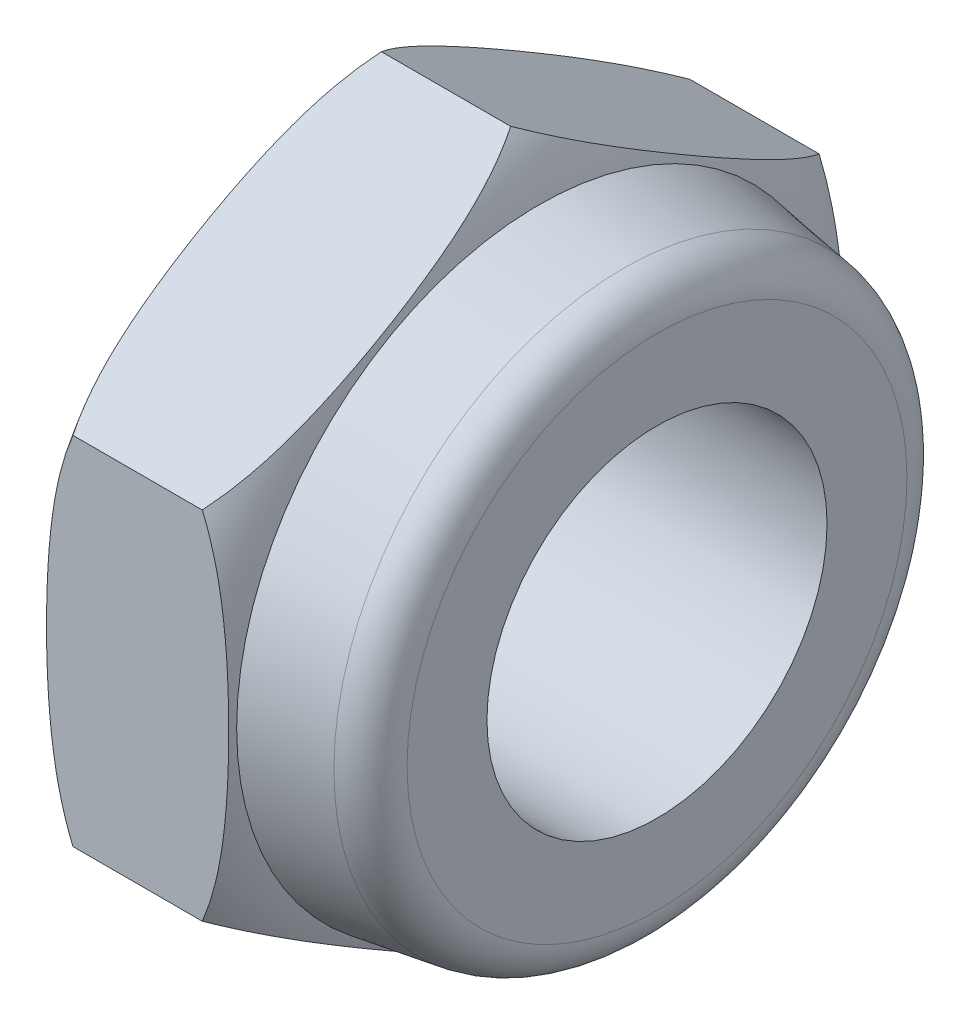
SolidWorks part; units mm, degrees
ref_plane "Front" through (0, 0, 0) normal (0, 0, 1) x (1, 0, 0)
ref_plane "Top" through (0, 0, 0) normal (0, 1, 0) x (1, 0, 0)
ref_plane "Right" through (0, 0, 0) normal (1, 0, 0) x (0, 0, -1)
sketch "Sketch1" plane through (0, 0, 0) normal (1, 0, 0) x (0, 0, -1)
  circle A0 centre (0, 0) radius 2.54
  dimension "D1" = 5.08
extrude "Place Holder" add sketch "Sketch1" along normal blind 0.254
sketch "Sketch4" plane through (0, 0, 0) normal (0, 0, 1) x (1, 0, 0)
  line L0 (0, 3.5014) -> (6.35, 3.5014)
  line L1 (3.3381, 7.3323) -> (0.6751, 7.3323)
  line L2 (0, 5.4993) -> (4.0132, 5.4993) construction
  line L3 (0, 5.4993) -> (0, 3.5014)
  line L4 (6.35, 5.1462) -> (6.35, 3.5014)
  line L5 (0, 3.5014) -> (0, 0) construction
  line L6 (3.9187, 6.2239) -> (5.6542, 5.9572)
  line L7 (0, 0) -> (14.2149, 0) construction
  arc A0 (0.6751, 7.3323) -> (0, 5.4993) centre (2.8263, 5.4993) ccw
  arc A1 (3.9187, 6.2239) -> (3.3381, 7.3323) centre (1.1869, 5.4993) ccw
  arc A2 (6.35, 5.1462) -> (5.6542, 5.9572) centre (5.5296, 5.1462) ccw
revolve "Revolve2" add sketch "Sketch4" angle 360 about L7
sketch "Sketch5" plane through (0, 0, 0) normal (-1, 0, 0) x (0, 0, 1)
  line L1 (0, 7.3323) -> (-6.35, 3.6662)
  line L2 (-6.35, 3.6662) -> (-6.35, -3.6662)
  line L3 (-6.35, -3.6662) -> (0, -7.3323)
  line L4 (0, -7.3323) -> (6.35, -3.6662)
  line L5 (6.35, -3.6662) -> (6.35, 3.6662)
  line L6 (6.35, 3.6662) -> (0, 7.3323)
  circle A0 centre (0, 0) radius 6.35 construction
  circle A1 centre (0, 0) radius 8.9002
extrude "Cut-Extrude2" cut sketch "Sketch5" against normal through all
sketch "Sketch6" plane through (0, 0, 0) normal (0, 0, 1) x (1, 0, 0)
  line L0 (0, 7.8105) -> (2.0433, 9.525)
  line L1 (2.0433, 9.525) -> (5.5626, 9.525)
  line L2 (5.5626, 9.525) -> (5.5626, 4.5987)
  line L3 (0, 7.8105) -> (0, 5.3518)
  line L4 (0.7938, 4.558) -> (5.522, 4.558)
  line L5 (5.522, 4.558) -> (5.5626, 4.5987)
  line L6 (0, 0) -> (29.1096, 0) construction
  line L7 (0.7938, 4.558) -> (0, 5.3518)
  line L8 (0, 5.3518) -> (0, 0) construction
revolve "Revolve3" [suppressed] add sketch "Sketch6" angle 360 about L6
sketch "Sketch7" [suppressed] plane through (9.652, 0, 0) normal (1, 0, 0) x (0, 0, -1)
  line L0 (0, 0) -> (0, 11.4545) construction
  line L3 (-15.113, 2.413) -> (-15.113, -2.413)
  line L4 (15.113, 2.413) -> (15.113, -2.413)
  line L5 (0, 0) -> (-12.263, 0) construction
  line L6 (-18.7685, 2.413) -> (-15.113, 2.413)
  line L7 (-18.7685, -2.413) -> (-15.113, -2.413)
  line L8 (-2.413, 18.7685) -> (-2.413, 15.113)
  line L9 (2.413, 18.7685) -> (2.413, 15.113)
  line L10 (-2.413, 15.113) -> (2.413, 15.113)
  line L13 (15.113, -2.413) -> (18.7685, -2.413)
  line L14 (15.113, 2.413) -> (18.7685, 2.413)
  line L15 (-3.1538, -15.113) -> (3.1538, -15.113)
  line L16 (-3.1538, -15.113) -> (-3.1538, -18.6583)
  line L17 (3.1538, -15.113) -> (3.1538, -18.6583)
  arc A0 (2.413, 18.7685) -> (-2.413, 18.7685) centre (0, 0) ccw
  arc A1 (18.7685, -2.413) -> (18.7685, 2.413) centre (0, 0) ccw
  arc A2 (-3.1538, -18.6583) -> (3.1538, -18.6583) centre (0, 0) ccw
  arc A3 (-18.7685, 2.413) -> (-18.7685, -2.413) centre (0, 0) ccw
extrude "Cut-Extrude3" [suppressed] cut sketch "Sketch7" against normal through all
equation "\"D6@Sketch7\"=\"D5@Sketch7\""
equation "\"D8@Sketch7\"=.5*\"D5@Sketch7\""
equation "\"D7@Sketch7\" = .5*\"D5@Sketch7\""
equation "\"D3@Sketch7\" = \"KID@Sketch7\""
equation "\"D2@Sketch7\"=.5*\"KID@Sketch7\""
equation "\"D4@Sketch7\" = .5*\"KID@Sketch7\""
equation "\"D1@Sketch7\" = .5*\"OD@Sketch6\""
equation "\"D4@Sketch6\"=.85*\"Width@Sketch6\""
